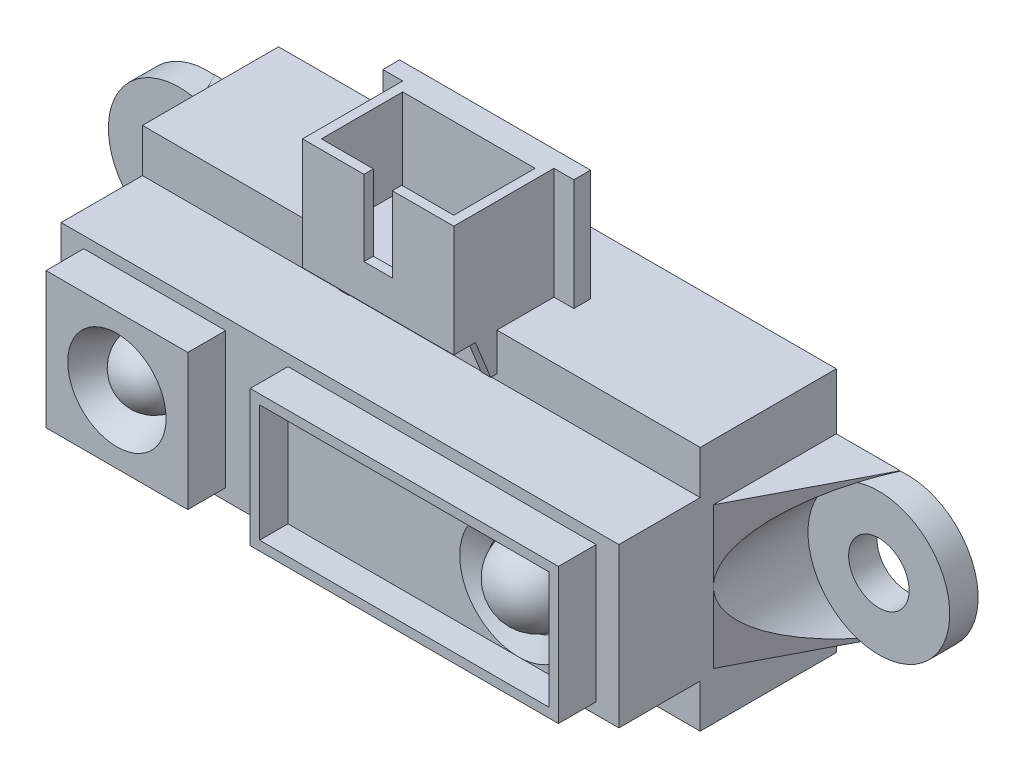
SolidWorks part; units mm, degrees
ref_plane "Front Plane" through (0, 0, 0) normal (0, 0, 1) x (1, 0, 0)
ref_plane "Top Plane" through (0, 0, 0) normal (0, 1, 0) x (1, 0, 0)
ref_plane "Right Plane" through (0, 0, 0) normal (1, 0, 0) x (0, 0, -1)
ref_plane "Plane1" through (0, 0, 6.3) normal (0, 0, -1) x (-1, 0, 0)
sketch "Sketch1" plane through (0, 0, 6.3) normal (0, 0, -1) x (-1, 0, 0)
  line L0 (-33.25, 2.5231) -> (3.75, 2.5231)
  line L1 (3.75, 10.0231) -> (-33.25, 10.0231)
  arc A0 (3.75, 2.5231) -> (3.75, 10.0231) centre (3.75, 6.2731) ccw
  arc A1 (-33.25, 10.0231) -> (-33.25, 2.5231) centre (-33.25, 6.2731) ccw
  dimension "D1" = 3.75
  dimension "D2" = 37
extrude "Boss-Extrude1" add sketch "Sketch1" against normal blind 1.5
sketch "Sketch2" plane through (0, 0, 7.8) normal (0, 0, 1) x (1, 0, 0)
  line L0 (-3.75, 10.0231) -> (33.25, 10.0231)
  line L1 (33.25, 2.5231) -> (-3.75, 2.5231)
  line L2 (-3.75, 10.0231) -> (33.25, 10.0231) construction
  arc A0 (-3.75, 2.5231) -> (-3.75, 10.0231) centre (-3.75, 6.2731) ccw
  arc A1 (33.25, 10.0231) -> (33.25, 2.5231) centre (33.25, 6.2731) ccw
  dimension "D1" = 3.75
  dimension "D2" = 37
  dimension "D3" = 3.75
extrude "Boss-Extrude2" add sketch "Sketch2" along normal blind 5
sketch "Sketch3" plane through (0, 2.5231, 0) normal (0, -1, 0) x (1, 0, 0)
  line L0 (29.5, 12.8) -> (29.5, 6.3)
  line L1 (29.5, 6.3) -> (0, 6.3)
  line L2 (0, 6.3) -> (0, 12.8)
  line L3 (0, 12.8) -> (29.5, 12.8)
  line L4 (33.25, 7.8) -> (33.25, 6.3) construction
  line L5 (33.25, 6.3) -> (-3.75, 6.3) construction
  dimension "D1" = 3.75
  dimension "D2" = 33.25
  dimension "D3" = 6.5
extrude "Boss-Extrude3" add sketch "Sketch3" along normal blind 2.5231
sketch "Sketch4" plane through (0, 0, 12.8) normal (0, 0, 1) x (1, 0, 0)
  line L0 (29.5, 10.0231) -> (29.5, 0)
  line L1 (29.5, 0) -> (0, 0)
  line L2 (0, 0) -> (0, 10.0231)
  line L3 (0, 10.0231) -> (29.5, 10.0231)
  line L4 (0, 0) -> (0, 2.5231) construction
  line L5 (29.5, 0) -> (0, 0) construction
  dimension "D1" = 29.5
  dimension "D2" = 10.0231
extrude "Boss-Extrude4" add sketch "Sketch4" along normal blind 5
sketch "Sketch5" plane through (0, 10.0231, 0) normal (0, 1, 0) x (-1, 0, 0)
  line L0 (0, 17.8) -> (0, 6.3)
  line L1 (0, 6.3) -> (-29.5, 6.3)
  line L2 (-29.5, 6.3) -> (-29.5, 17.8)
  line L3 (-29.5, 17.8) -> (0, 17.8)
  line L4 (3.75, 7.8) -> (3.75, 6.3) construction
  line L5 (3.75, 6.3) -> (-33.25, 6.3) construction
  dimension "D1" = 3.75
  dimension "D2" = 33.25
  dimension "D3" = 11.5
extrude "Boss-Extrude5" add sketch "Sketch5" along normal blind 2.9769
sketch "Sketch6" plane through (0, 0, 0) normal (-1, 0, 0) x (0, 0, 1)
  line L0 (13.5, 13) -> (13.5, 10.7)
  line L1 (13.5, 10.7) -> (17.8, 10.7)
  line L2 (17.8, 10.7) -> (17.8, 13)
  line L3 (17.8, 13) -> (13.5, 13)
  line L4 (17.8, 0) -> (6.3, 0) construction
  line L5 (17.8, 13) -> (17.8, 0) construction
  dimension "D1" = 4.3
  dimension "D2" = 10.7
  dimension "D3" = 13
extrude "Cut-Extrude1" cut sketch "Sketch6" against normal through all
sketch "Sketch7" plane through (0, 13, 0) normal (0, 1, 0) x (-1, 0, 0)
  line L0 (-9.7, 13.5) -> (-9.7, 9.6)
  line L1 (-9.7, 9.6) -> (-19.8, 9.6)
  line L2 (-19.8, 9.6) -> (-19.8, 13.5)
  line L3 (-19.8, 13.5) -> (-9.7, 13.5)
  line L4 (0, 6.3) -> (0, 13.5) construction
  line L5 (0, 13.5) -> (-29.5, 13.5) construction
  dimension "D1" = 9.7
  dimension "D2" = 19.8
  dimension "D3" = 3.9
extrude "Boss-Extrude6" add sketch "Sketch7" along normal blind 5.9
sketch "Sketch8" plane through (0, 0, 13.5) normal (0, 0, 1) x (1, 0, 0)
  line L0 (18.75, 18.9) -> (18.75, 13)
  line L1 (18.75, 13) -> (10.75, 13)
  line L2 (10.75, 13) -> (10.75, 18.9)
  line L3 (10.75, 18.9) -> (18.75, 18.9)
  line L4 (0, 13) -> (0, 10.7) construction
  line L5 (29.5, 10.7) -> (0, 10.7) construction
  dimension "D1" = 10.75
  dimension "D2" = 18.75
  dimension "D3" = 2.3
  dimension "D4" = 8.2
extrude "Boss-Extrude7" add sketch "Sketch8" along normal blind 2.2838
sketch "Sketch9" plane through (0, 13, 0) normal (0, -1, 0) x (1, 0, 0)
  line L0 (11.25, 14.6419) -> (11.25, 13.5)
  line L1 (11.25, 13.5) -> (10.75, 13.5)
  line L2 (10.75, 13.5) -> (10.75, 14.6419)
  line L3 (10.75, 14.6419) -> (11.25, 14.6419)
  line L4 (18.75, 15.7838) -> (18.75, 13.5) construction
  line L5 (10.75, 13.5) -> (18.75, 13.5) construction
  dimension "D1" = 7.5
  dimension "D2" = 8
  dimension "D3" = 1.1419
extrude "Boss-Extrude8" add sketch "Sketch9" along normal blind 2
ref_plane "Plane2" through (18.75, 0, 0) normal (1, 0, 0) x (0, 0, -1)
sketch "Sketch10" plane through (18.75, 0, 0) normal (1, 0, 0) x (0, 0, -1)
  line L0 (-14.6419, 11) -> (-13.5, 11)
  line L1 (-13.5, 11) -> (-13.5, 13)
  line L2 (-13.5, 13) -> (-14.6419, 13)
  line L3 (-14.6419, 13) -> (-14.6419, 11)
  dimension "D1" = 1.1419
  dimension "D2" = 2
extrude "Boss-Extrude9" add sketch "Sketch10" against normal blind 0.5
sketch "Sketch11" plane through (0, 0, 13.5) normal (0, 0, 1) x (1, 0, 0)
  line L0 (10.75, 18.9) -> (9.7, 18.9)
  line L1 (9.7, 18.9) -> (9.7, 13)
  line L2 (9.7, 13) -> (10.75, 13)
  line L3 (10.75, 13) -> (10.75, 18.9)
  line L4 (18.25, 11) -> (18.25, 13) construction
  line L5 (10.75, 11) -> (11.25, 11) construction
  dimension "D1" = 7.5
  dimension "D2" = 8.55
  dimension "D3" = 2
  dimension "D4" = 7.9
extrude "Cut-Extrude2" cut sketch "Sketch11" against normal blind 3.0162
ref_plane "Plane3" through (14.75, 0, 0) normal (-1, 0, 0) x (0, 0, 1)
mirror "Mirror1" about plane through (14.75, 0, 0) normal (-1, 0, 0) of "Cut-Extrude2"
sketch "Sketch14" plane through (0, 18.9, 0) normal (0, 1, 0) x (-1, 0, 0)
  line L0 (-11.25, 10.9838) -> (-11.25, 15.2838)
  line L1 (-11.25, 15.2838) -> (-18.25, 15.2838)
  line L2 (-18.25, 15.2838) -> (-18.25, 10.9838)
  line L3 (-18.25, 10.9838) -> (-11.25, 10.9838)
  line L4 (-19.8, 10.4838) -> (-19.8, 9.6) construction
  line L5 (-19.8, 9.6) -> (-9.7, 9.6) construction
  dimension "D1" = 1.55
  dimension "D2" = 8.55
  dimension "D3" = 1.3838
  dimension "D4" = 5.6838
extrude "Cut-Extrude3" cut sketch "Sketch14" against normal blind 4.5
sketch "Sketch15" plane through (0, 0, 15.7838) normal (0, 0, 1) x (1, 0, 0)
  line L0 (15.5, 18.9) -> (14, 18.9)
  line L1 (14, 18.9) -> (14, 14.9)
  line L2 (14, 14.9) -> (15.5, 14.9)
  line L3 (15.5, 14.9) -> (15.5, 18.9)
  line L4 (10.75, 18.9) -> (10.75, 13) construction
  line L5 (18.75, 18.9) -> (10.75, 18.9) construction
  dimension "D1" = 3.25
  dimension "D2" = 4.75
  dimension "D3" = 4
extrude "Cut-Extrude4" cut sketch "Sketch15" against normal up to next
sketch "Sketch16" plane through (0, 0, 0) normal (-1, 0, 0) x (0, 0, 1)
  line L0 (13.5, 2.3) -> (13.5, 0)
  line L1 (13.5, 0) -> (17.8, 0)
  line L2 (17.8, 0) -> (17.8, 2.3)
  line L3 (17.8, 2.3) -> (13.5, 2.3)
  line L4 (6.3, 13) -> (13.5, 13) construction
  line L5 (17.8, 10.7) -> (17.8, 0) construction
  dimension "D1" = 4.3
  dimension "D2" = 10.7
  dimension "D3" = 13
extrude "Cut-Extrude5" cut sketch "Sketch16" against normal through all
sketch "Sketch17" plane through (0, 0, 17.8) normal (0, 0, 1) x (1, 0, 0)
  line L0 (1.2, 10.1) -> (8.7, 10.1)
  line L1 (8.7, 10.1) -> (8.7, 2.9)
  line L2 (8.7, 2.9) -> (1.2, 2.9)
  line L3 (1.2, 2.9) -> (1.2, 10.1)
  line L4 (0, 10.7) -> (0, 2.3) construction
  line L5 (0, 2.3) -> (29.5, 2.3) construction
  dimension "D1" = 1.2
  dimension "D2" = 8.7
  dimension "D3" = 0.6
  dimension "D4" = 7.8
extrude "Boss-Extrude10" add sketch "Sketch17" along normal blind 2
sketch "Sketch18" plane through (0, 0, 17.8) normal (0, 0, 1) x (1, 0, 0)
  line L0 (28.3, 2.9) -> (12, 2.9)
  line L1 (12, 2.9) -> (12, 10.1)
  line L2 (12, 10.1) -> (28.3, 10.1)
  line L3 (28.3, 10.1) -> (28.3, 2.9)
  line L4 (0, 10.7) -> (0, 2.3) construction
  line L5 (0, 2.3) -> (29.5, 2.3) construction
  dimension "D1" = 12
  dimension "D2" = 28.3
  dimension "D3" = 0.6
  dimension "D4" = 7.8
extrude "Boss-Extrude11" add sketch "Sketch18" along normal blind 2
sketch "Sketch19" plane through (0, 0, 19.8) normal (0, 0, 1) x (1, 0, 0)
  line L0 (12.5, 3.4) -> (27.8, 3.4)
  line L1 (27.8, 3.4) -> (27.8, 9.6)
  line L2 (27.8, 9.6) -> (12.5, 9.6)
  line L3 (12.5, 9.6) -> (12.5, 3.4)
  line L4 (28.3, 2.9) -> (28.3, 10.1) construction
  line L5 (28.3, 10.1) -> (12, 10.1) construction
  dimension "D1" = 0.5
  dimension "D2" = 15.8
  dimension "D3" = 0.5
  dimension "D4" = 6.7
extrude "Cut-Extrude6" cut sketch "Sketch19" against normal blind 1.5
sketch "Sketch20" plane through (0, 0, 6.3) normal (0, 0, -1) x (-1, 0, 0)
  line L0 (-29, 0.5) -> (-0.5, 0.5)
  line L1 (-0.5, 0.5) -> (-0.5, 12.5)
  line L2 (-0.5, 12.5) -> (-29, 12.5)
  line L3 (-29, 12.5) -> (-29, 0.5)
  line L4 (0, 0) -> (0, 2.5231) construction
  line L5 (0, 0) -> (-29.5, 0) construction
  dimension "D1" = 0.5
  dimension "D2" = 29
  dimension "D3" = 0.5
  dimension "D4" = 12.5
extrude "Cut-Extrude7" cut sketch "Sketch20" against normal blind 3.3
draft "Draft1" type of draft neutral plane draft angle 62.526 faces to draft 2 parameters "D1"=62.526
draft "Draft2" type of draft neutral plane draft angle 62.526 faces to draft 2 parameters "D1"=62.526
draft "Draft3" type of draft neutral plane draft angle 22.002 faces to draft 2 parameters "D1"=22.002
hole_wizard "Ø3.2 (3.2) Diameter Hole1" positions "Sketch22" profile "Sketch21" hole size "Ø3.2" standard "ANSI Metric"
sketch "Sketch22" plane through (0, 0, 7.8) normal (0, 0, 1) x (1, 0, 0)
  point P0 (-3.75, 6.2731)
  point P1 (33.25, 6.2731)
sketch "Sketch21" plane through (-3.75, 6.2731, 7.8) normal (1, 0, 0) x (0, -1, 0)
  line L0 (0, 0) -> (0, 1.5)
  line L1 (0, 1.5) -> (1.6, 1.5)
  line L2 (1.6, 1.5) -> (1.6, 0)
  line L5 (1.6, 0) -> (0, 0)
  line L11 (0, -6.35) -> (0, 107.95) construction
  dimension "Thru Hole Dia." = 3.2
  dimension "Thru Hole Depth" = 1.5
ref_plane "Plane4" through (0, 6.5, 0) normal (0, -1, 0) x (1, 0, 0)
sketch "Sketch23" plane through (0, 6.5, 0) normal (0, -1, 0) x (1, 0, 0)
  line L0 (7.55, 19.8) -> (4.95, 19.8)
  line L1 (4.95, 19.8) -> (4.95, 13.6824)
  line L2 (4.95, 13.6824) -> (7.55, 19.8)
  line L3 (4.95, 19.8) -> (4.95, 13.6824) construction
  dimension "D1" = 2.6
  dimension "D2" = 6.1176
revolve "Cut-Revolve1" cut sketch "Sketch23" angle 360 about L3
hole_wizard "CSK for M3.5 Flat Head Machine Screw1" positions "Sketch25" profile "Sketch24" countersink size "M3.5" standard "ANSI Metric"
sketch "Sketch25" plane through (0, 0, 18.3) normal (0, 0, 1) x (1, 0, 0)
  point P0 (24.6832, 6.5)
sketch "Sketch24" plane through (24.6832, 6.5, 18.3) normal (1, 0, 0) x (0, -1, 0)
  line L0 (0, 0) -> (0, 1)
  line L1 (0, 1) -> (2.1, 1)
  line L2 (2.1, 1) -> (2.1, 0.5)
  line L3 (2.1, 0.5) -> (3.1, 0)
  line L5 (3.1, 0) -> (0, 0)
  line L6 (-2.1, 0.5) -> (-3.1, 0) construction
  line L10 (0, 1) -> (-2.1, 1) construction
  line L11 (0, -6.35) -> (0, 107.95) construction
  dimension "Hole Dia." = 4.2
  dimension "Hole Depth" = 1
  dimension "Near C'Sink Dia." = 6.2
  dimension "Near C'Sink Angle" = 126.87
  dimension "Drill Angle" = 180
imported_body "Surface-Imported1"
thicken "Thicken1"
imported_body "Surface-Imported2"
thicken "Thicken2"
